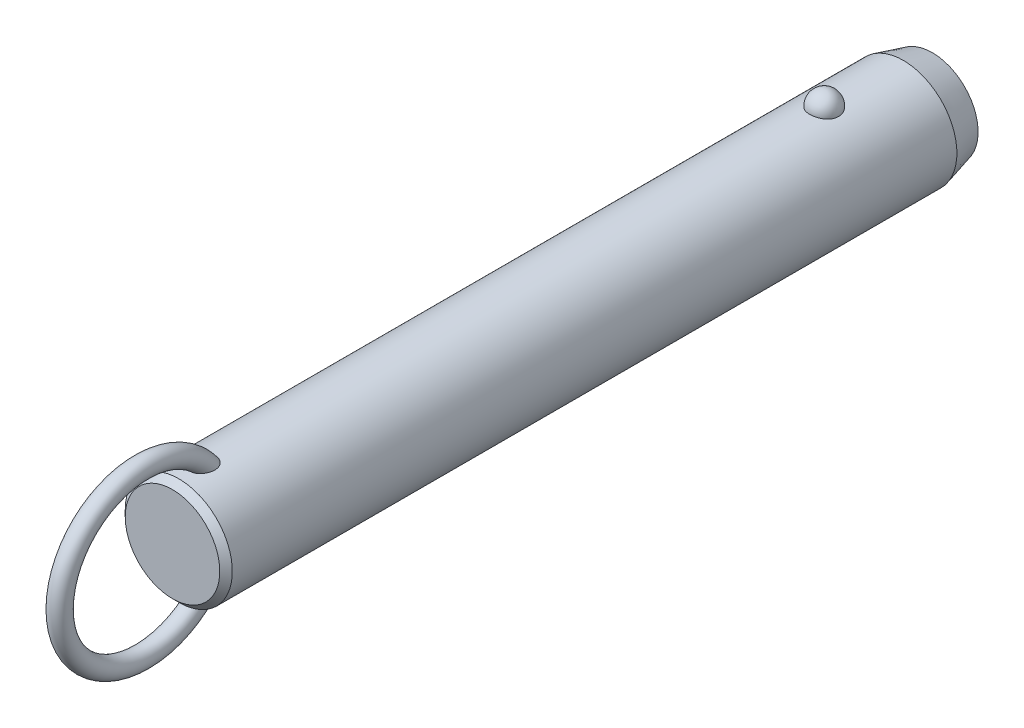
SolidWorks part; units mm, degrees
ref_plane "Front Plane" through (0, 0, 0) normal (0, 0, 1) x (1, 0, 0)
ref_plane "Top Plane" through (0, 0, 0) normal (0, 1, 0) x (1, 0, 0)
ref_plane "Right Plane" through (0, 0, 0) normal (1, 0, 0) x (0, 0, -1)
sketch "Sketch2" plane through (0, 0, 0) normal (0, 0, 1) x (1, 0, 0)
  circle A0 centre (0, 0) radius 11.1
  point P3 (0, 11.1)
  dimension "D1" = 22.2
extrude "Boss-Extrude1" add sketch "Sketch2" along normal blind 119.4
sketch "Sketch3" plane through (0, 0, 0) normal (0, 0, -1) x (-1, 0, 0)
  circle A0 centre (0, 0) radius 11.1
  dimension "D1" = 22.2
extrude "Boss-Extrude2" add sketch "Sketch3" along normal blind 25.4
chamfer "Chamfer1" distance 6 angle 15 1 edges at (-11.1, 0, -25.4)
sketch "Sketch12" plane through (0, 0, 0) normal (1, 0, 0) x (0, 0, -1)
  line L0 (-119.4, 11.1) -> (-119.4, -11.1) construction
  point P0 (-119.4, 0)
sketch "Sketch13" plane through (0, 0, 0) normal (1, 0, 0) x (0, 0, -1)
  circle A0 centre (-138.45, 0) radius 19.05
  point P2 (-119.4, 0)
  dimension "D1" = 38.1
sketch "Sketch14" plane through (0, 0, 0) normal (0, 1, 0) x (1, 0, 0)
  circle A0 centre (0, -121.4) radius 2
  point P2 (0, -119.4)
  dimension "D1" = 4
sweep "Sweep1" add profiles "Sketch14" path "Sketch13"
sketch "Sketch15" plane through (0, 0, 119.4) normal (0, 0, 1) x (1, 0, 0)
  circle A0 centre (0, 0) radius 11.1
  dimension "D1" = 22.2
extrude "Boss-Extrude3" add sketch "Sketch15" along normal blind 12.7
chamfer "Chamfer2" distance 1.3 angle 45 1 edges at (11.1, 0, 132.1)
sketch "Sketch18" plane through (0, 0, 0) normal (1, 0, 0) x (0, 0, -1)
  line L0 (19.4, 11.1) -> (-122.968, 11.1) construction
  line L1 (3, 14.1) -> (3, 8.1)
  line L2 (-122.968, -11.1) -> (19.4, -11.1) construction
  arc A0 (3, 14.1) -> (3, 8.1) centre (3, 11.1) ccw
  point P4 (0, 11.1)
  dimension "D1" = 25.2
revolve "Revolve1" add sketch "Sketch18" angle 360 about L1
